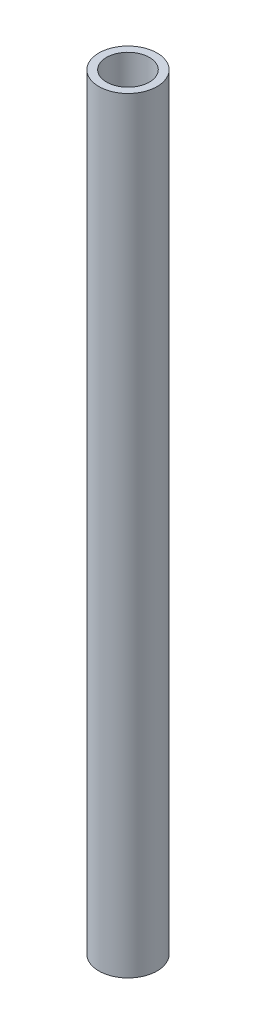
SolidWorks part; units mm, degrees
ref_plane "Front Plane" through (0, 0, 0) normal (0, 0, 1) x (1, 0, 0)
ref_plane "Top Plane" through (0, 0, 0) normal (0, 1, 0) x (1, 0, 0)
ref_plane "Right Plane" through (0, 0, 0) normal (1, 0, 0) x (0, 0, -1)
sketch "Sketch1" plane through (0, 0, 0) normal (0, 0, 1) x (1, 0, 0)
  line L0 (0, 0) -> (0, -500)
  line L1 (0, -500) -> (5, -500)
  line L2 (5, -500) -> (5, 0)
  line L3 (5, 0) -> (0, 0)
  line L4 (19, 0) -> (19, -450) construction
  dimension "D1" = 500
  dimension "D2" = 14
  dimension "D3" = 5
revolve "Revolve1" add sketch "Sketch1" angle 360 about L4
